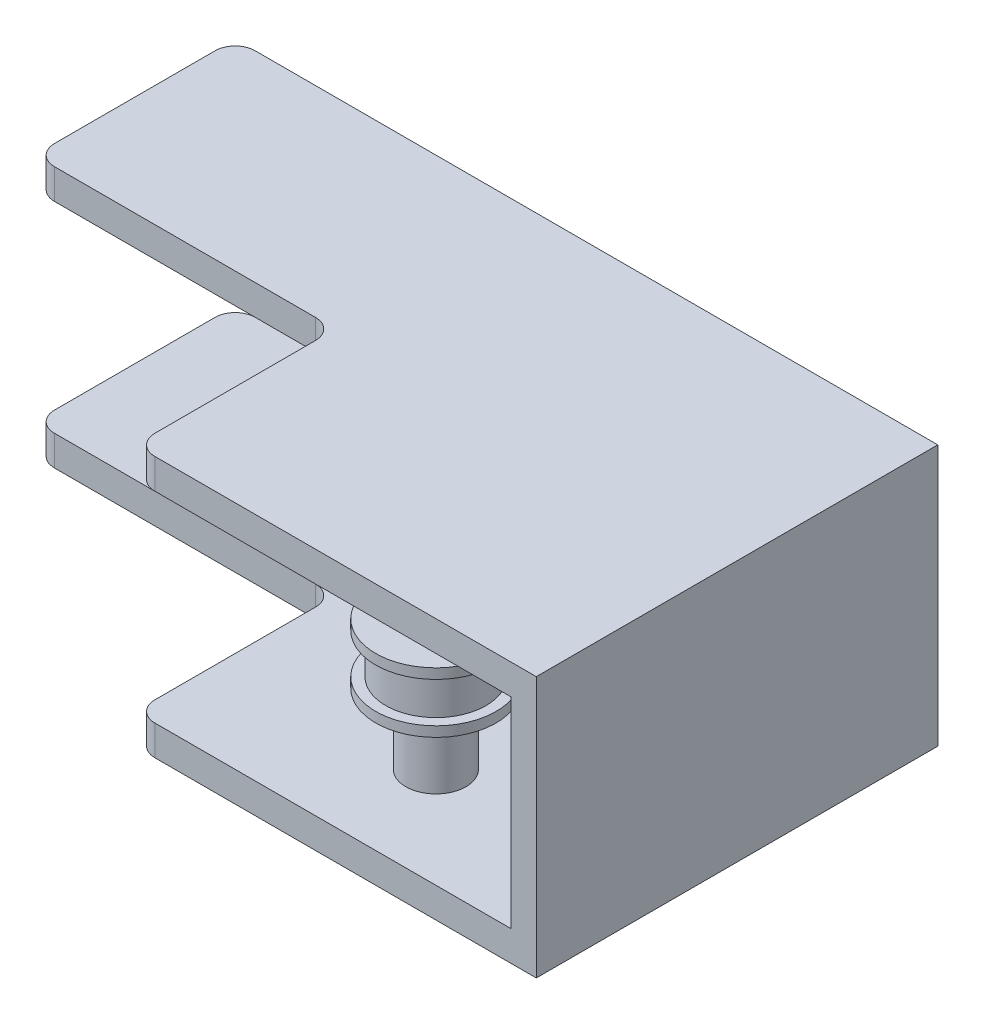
SolidWorks part; units mm, degrees
ref_plane "前视基准面" through (0, 0, 0) normal (0, 0, 1) x (1, 0, 0)
ref_plane "上视基准面" through (0, 0, 0) normal (0, 1, 0) x (1, 0, 0)
ref_plane "右视基准面" through (0, 0, 0) normal (1, 0, 0) x (0, 0, -1)
other "Configuration Table"
sketch "草图1" plane through (0, 0, 0) normal (0, 1, 0) x (1, 0, 0)
  line L0 (-22, 0) -> (-48, 0)
  line L1 (-18, -20) -> (18, -20)
  line L3 (-20, 20) -> (18, 20)
  line L4 (20, -18) -> (20, 18)
  line L5 (-20, -20) -> (20, 20) construction
  line L6 (-20, 20) -> (20, -20) construction
  line L7 (-50, 2) -> (-50, 18)
  line L8 (-48, 20) -> (-20, 20)
  line L9 (-20, -2) -> (-20, -18)
  line L10 (18, -20) -> (20, -20)
  line L11 (20, -20) -> (20, -18)
  line L12 (18, 20) -> (20, 20)
  line L13 (20, 20) -> (20, 18)
  arc A0 (-48, 20) -> (-50, 18) centre (-48, 18) ccw
  arc A1 (-48, 0) -> (-50, 2) centre (-48, 2) cw
  arc A2 (-20, -2) -> (-22, 0) centre (-22, -2) ccw
  arc A3 (-18, -20) -> (-20, -18) centre (-18, -18) cw
  point P0 (0, 0)
  dimension "D1" = 2
  dimension "D2" = 2
  dimension "D3" = 2
  dimension "D4" = 2
extrude "凸台-拉伸1" add sketch "草图1" along normal blind 3
sketch "草图2" plane through (0, 0, 0) normal (0, -1, 0) x (1, 0, 0)
  circle A0 centre (0, 10) radius 3
extrude "凸台-拉伸2" add sketch "草图2" along normal blind 7
sketch "草图3" plane through (0, -7, 0) normal (0, -1, 0) x (1, 0, 0)
  circle A0 centre (0, 10) radius 6
extrude "凸台-拉伸4" add sketch "草图3" along normal blind 1
sketch "草图4" plane through (0, -8, 0) normal (0, -1, 0) x (1, 0, 0)
  circle A0 centre (0, 10) radius 5
extrude "凸台-拉伸5" add sketch "草图4" along normal blind 4
sketch "草图5" plane through (0, -12, 0) normal (0, -1, 0) x (1, 0, 0)
  circle A0 centre (0, 10) radius 6
extrude "凸台-拉伸6" add sketch "草图5" along normal blind 1
sketch "草图6" plane through (0, -13, 0) normal (0, -1, 0) x (1, 0, 0)
  circle A0 centre (0, 10) radius 3
extrude "凸台-拉伸7" add sketch "草图6" along normal blind 7
sketch "草图13" plane through (0, 0, 0) normal (0, -1, 0) x (1, 0, 0)
  line L1 (-18, 20) -> (20, 20) construction
  line L3 (20, -20) -> (17.5, -20)
  line L4 (20, -20) -> (20, 20)
  line L5 (20, 20) -> (17.5, 20)
  line L6 (17.5, -20) -> (17.5, 20)
extrude "凸台-拉伸19" add sketch "草图13" along normal blind 20
sketch "草图15" plane through (0, -20, 0) normal (0, -1, 0) x (1, 0, 0)
  line L4 (20, 20) -> (17.5, 20)
  line L5 (17.5, 20) -> (17.5, -20)
  line L6 (-48, -20) -> (17.5, -20)
  line L7 (17.5, -20) -> (17.5, 20)
  line L8 (17.5, 20) -> (-18, 20)
  line L9 (-20, 18) -> (-20, 2)
  line L10 (-22, 0) -> (-48, 0)
  line L11 (-50, -2) -> (-50, -18)
  line L12 (-48, -20) -> (17.5, -20)
  line L14 (17.5, 20) -> (-18, 20)
  line L15 (-20, 18) -> (-20, 2)
  line L16 (-22, 0) -> (-48, 0)
  line L17 (-50, -2) -> (-50, -18)
  line L18 (17.5, -20) -> (20, -20)
  line L19 (20, -20) -> (20, 20)
  line L20 (20, 20) -> (17.5, 20)
  line L22 (17.5, -20) -> (20, -20)
  line L23 (20, -20) -> (20, 20)
  arc A4 (-18, 20) -> (-20, 18) centre (-18, 18) ccw
  arc A5 (-22, 0) -> (-20, 2) centre (-22, 2) ccw
  arc A6 (-48, 0) -> (-50, -2) centre (-48, -2) ccw
  arc A7 (-50, -18) -> (-48, -20) centre (-48, -18) ccw
  arc A8 (-18, 20) -> (-20, 18) centre (-18, 18) ccw
  arc A9 (-22, 0) -> (-20, 2) centre (-22, 2) ccw
  arc A10 (-48, 0) -> (-50, -2) centre (-48, -2) ccw
  arc A11 (-50, -18) -> (-48, -20) centre (-48, -18) ccw
  dimension "D1" = 0
  dimension "D2" = 0
extrude "凸台-拉伸20" add sketch "草图15" along normal blind 3
